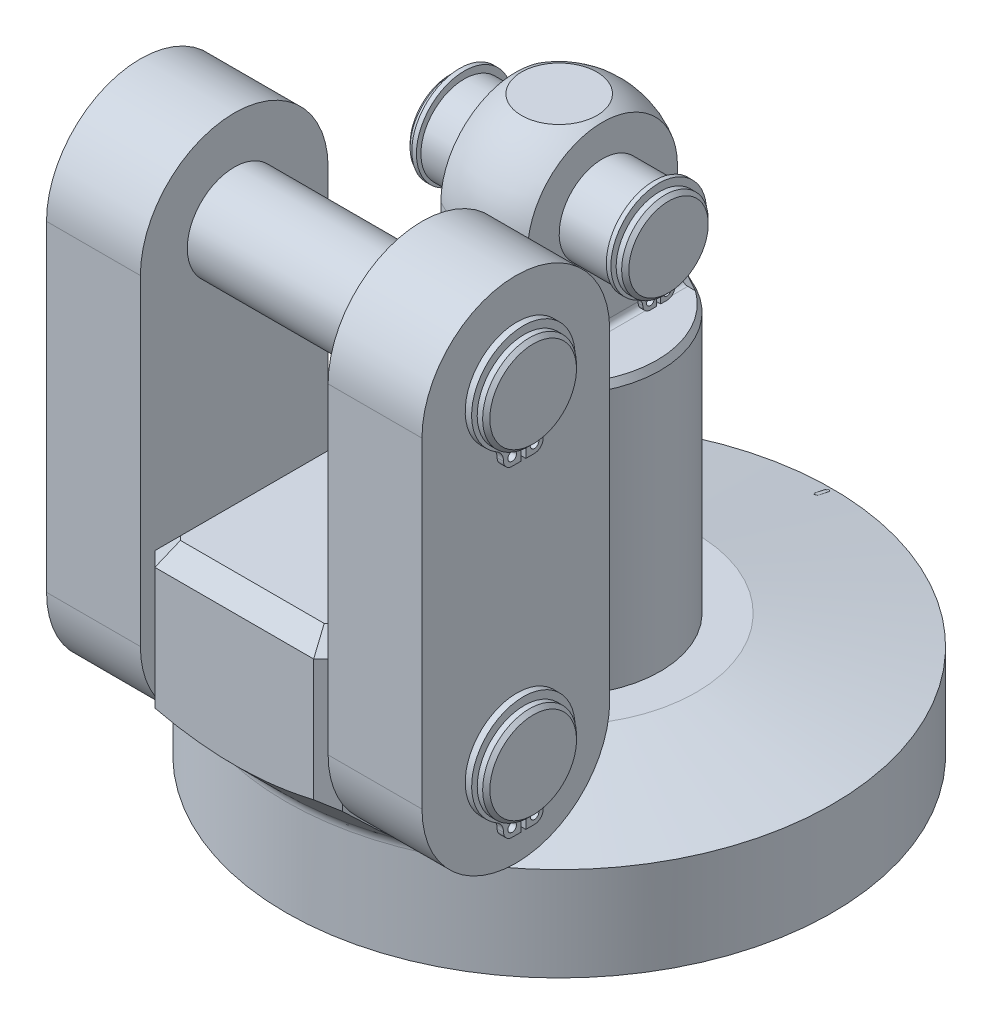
SolidWorks part; units mm, degrees
ref_plane "Front Plane" through (0, 0, 0) normal (0, 0, 1) x (1, 0, 0)
ref_plane "Top Plane" through (0, 0, 0) normal (0, 1, 0) x (1, 0, 0)
ref_plane "Right Plane" through (0, 0, 0) normal (1, 0, 0) x (0, 0, -1)
sketch "Sketch1" plane through (0, 0, 0) normal (0, 1, 0) x (1, 0, 0)
  line L0 (-13, 0) -> (13, 0)
  line L1 (13, 0) -> (13, -45)
  line L2 (13, -45) -> (-13, -45)
  line L3 (-13, -45) -> (-13, 0)
  line L4 (0, 1.05) -> (0, -22.05) construction
  dimension "D1" = 26
  dimension "D2" = 45
extrude "Extrude1" add sketch "Sketch1" along normal blind 42
sketch "S2D0003" plane through (0, 0, 0) normal (1, 0, 0) x (0, 0, -1)
  line L0 (0, 0) -> (0, 17)
  line L1 (-45, 0) -> (0, 0)
  line L2 (-45, 0) -> (-45, 11.4735)
  line L3 (0, 17) -> (-19, 17)
  line L4 (-19, 17) -> (-45, 11.4735)
  line L5 (0, 9.45) -> (0, -2.5987) construction
  line L6 (0, 42) -> (0, 0) construction
  line L8 (-45, 0) -> (0, 0) construction
  line L10 (-45, 42) -> (-45, 0) construction
  dimension "D1" = 17
  dimension "D2" = 12
  dimension "D3" = 38
sketch "S2D0004" plane through (0, 0, 0) normal (1, 0, 0) x (0, 0, -1)
  line L0 (-50, 26.2924) -> (-38.4318, 14.7242)
  line L1 (-37.846, 13.31) -> (-37.846, 0)
  line L2 (0, 16.6313) -> (0, -1.1122) construction
  line L3 (0, 42) -> (0, 0) construction
  line L5 (-45, 0) -> (0, 0) construction
  line L6 (-50, 26.2924) -> (-50, 0)
  line L7 (-50, 0) -> (-37.846, 0)
  line L8 (-45, 42) -> (-45, 0) construction
  arc A0 (-37.846, 13.31) -> (-38.4318, 14.7242) centre (-39.846, 13.31) ccw
  dimension "D4" = 2
  dimension "D1" = 75.692
  dimension "D2" = 13.31
  dimension "D3" = 45
  dimension "D5" = 5
sketch "Sketch4" plane through (0, 0, 0) normal (1, 0, 0) x (0, 0, -1)
  line L0 (0, 17) -> (19, 17)
  line L1 (19, 17) -> (19, 42)
  line L2 (19, 42) -> (0, 42)
  line L3 (0, 42) -> (0, 17)
  line L4 (0, 21.6) -> (0, 8.4) construction
  line L5 (0, 42) -> (0, 0) construction
  line L6 (-45, 42) -> (0, 42) construction
  dimension "D1" = 38
  dimension "D2" = 25
revolve "Cut-Revolve5" cut sketch "Sketch4" angle 360 about L4
revolve "Revolve1" add sketch "S2D0003" angle 360 about L5
revolve "Cut-Revolve4" cut sketch "S2D0004" angle 360 about L2
sketch "Sketch7" plane through (13, 0, 0) normal (1, 0, 0) x (0, 0, -1)
  line L0 (-37.846, 0) -> (37.846, 0) construction
  circle A0 centre (-32, 29) radius 6.5
  dimension "D1" = 13
  dimension "D2" = 29
  dimension "D3" = 32
extrude "Cut-Extrude3" cut sketch "Sketch7" against normal through all
fillet "Fillet1" radius 3.5052 2 edges at (-13, 29.5, 13.8564) (13, 29.5, 13.8564)
fillet "Fillet2" radius 4.7498 5 edges at (-11.296, 16.6296, 17.3972) (0, 17, 19) (11.333, 16.6213, 17.4197)
chamfer "Chamfer1" distance 2.0066 angle 45 2 edges at (-13, 32.5663, 45) (13, 32.5663, 45)
chamfer "Chamfer2" distance 2.5 angle 45 8 edges at (-13, 42, 31.6988) (-11.3793, 42, 17.4487) (0, 42, 19) (11.3793, 42, 17.4487) (-11.9967, 42, 43.9967) (13, 42, 31.6988) (11.9967, 42, 43.9967) (0, 42, 45)
ref_plane "Plane1" through (0, 0, 32) normal (0, 0, 1) x (1, 0, 0)
sketch "Sketch8" plane through (0, 0, 32) normal (0, 0, 1) x (1, 0, 0)
  line L0 (13, 29) -> (13, 15.5)
  line L1 (14.14, 14.36) -> (27.64, 14.36)
  line L2 (27.64, 14.36) -> (27.64, 29)
  line L3 (27.64, 29) -> (13, 29)
  line L4 (5.637, 29) -> (19.4125, 29) construction
  line L5 (-13, 29) -> (13, 29) construction
  line L6 (13, 42) -> (13, 23.1326) construction
  line L7 (0, 0) -> (0, 26.6501) construction
  line L8 (-27.64, 29) -> (-13, 29)
  line L9 (-27.64, 14.36) -> (-27.64, 29)
  line L10 (-14.14, 14.36) -> (-27.64, 14.36)
  line L11 (-13, 29) -> (-13, 15.5)
  arc A0 (13, 15.5) -> (14.14, 14.36) centre (14.14, 15.5) ccw
  arc A1 (-13, 15.5) -> (-14.14, 14.36) centre (-14.14, 15.5) cw
  dimension "D4" = 1.14
  dimension "D2" = 29.28
  dimension "D3" = 14.64
revolve "Cut-Revolve6" cut sketch "Sketch8" angle 360 about L4
sketch "Sketch10" plane through (0, 0, 0) normal (1, 0, 0) x (0, 0, -1)
  line L0 (0, 17) -> (0, 79.3)
  line L1 (0, 79.3) -> (5.2195, 79.3)
  line L2 (11.9951, 68.5) -> (11.9951, 57.3895)
  line L3 (11.9951, 57.3895) -> (13.9954, 53.1)
  line L4 (13.9954, 53.1) -> (13.9954, 17)
  line L5 (13.9954, 17) -> (0, 17)
  line L6 (0, 44.745) -> (0, 7.55) construction
  line L7 (22.759, -19) -> (-24.5324, -19) construction
  line L9 (19, 17) -> (-13.1229, 17) construction
  arc A0 (11.9951, 68.5) -> (5.2195, 79.3) centre (0, 68.5) ccw
  circle A1 centre (0, 68.5) radius 6 construction
  dimension "D2" = 11.9951
  dimension "D3" = 12
  dimension "D5" = 87.5
  dimension "D1" = 10.8
  dimension "D4" = 36
  dimension "D6" = 27.9908
  dimension "D7" = 23.9903
  dimension "D8" = 25
  dimension "D9" = 26.2
  dimension "D10" = 36.1
  dimension "D11" = 62.3
revolve "Revolve2" add sketch "Sketch10" angle 360 about L6
sketch "Sketch12" plane through (0, 0, 0) normal (0, 0, 1) x (1, 0, 0)
  line L0 (6, 79.3) -> (13.9954, 79.3)
  line L1 (13.9954, 79.3) -> (13.9954, 54.1)
  line L2 (13.9954, 54.1) -> (6.8, 54.1)
  line L3 (6, 54.9) -> (6, 79.3)
  line L4 (5.2195, 79.3) -> (-5.2195, 79.3) construction
  line L5 (13.9954, 17) -> (13.9954, 53.1) construction
  line L6 (-6, 54.9) -> (-6, 79.3)
  line L7 (-13.9954, 54.1) -> (-6.8, 54.1)
  line L8 (0, 38.525) -> (0, 26.975) construction
  line L9 (-13.9954, 79.3) -> (-13.9954, 54.1)
  line L10 (-6, 79.3) -> (-13.9954, 79.3)
  arc A0 (6, 54.9) -> (6.8, 54.1) centre (6.8, 54.9) ccw
  arc A1 (-6, 54.9) -> (-6.8, 54.1) centre (-6.8, 54.9) cw
  dimension "D3" = 0.8
  dimension "D1" = 12
  dimension "D2" = 25.2
extrude "Cut-Extrude5" cut sketch "Sketch12" against normal mid plane 22
sketch "Sketch14" plane through (6, 0, 0) normal (1, 0, 0) x (0, 0, -1)
  line L0 (5.2195, 79.3) -> (-5.2195, 79.3) construction
  circle A0 centre (0, 68.5) radius 6
  dimension "D2" = 12
  dimension "D1" = 10.8
extrude "Cut-Extrude7" cut sketch "Sketch14" against normal up to next
sketch "S2D0005" plane through (13, 0, 0) normal (1, 0, 0) x (0, 0, -1)
  line L0 (-45.0046, 73.4987) -> (-45, 28.9987)
  line L1 (-19.0046, 73.5013) -> (-19, 29.0013)
  line L2 (-32.0046, 73.5) -> (-32, 29) construction
  line L3 (0, 68.5) -> (-0.0006, 73.5038) construction
  line L4 (-0.0006, 73.5038) -> (-32.0046, 73.5) construction
  arc A0 (-19.0046, 73.5013) -> (-45.0046, 73.4987) centre (-32.0046, 73.5) ccw
  arc A1 (-45, 28.9987) -> (-19, 29.0013) centre (-32, 29) ccw
  circle A2 centre (-32.0046, 73.5) radius 6.5
  circle A3 centre (-32, 29) radius 6.5
  circle A6 centre (-32, 29) radius 6.5 construction
  dimension "D2" = 44.5
  dimension "D1" = 26
  dimension "D3" = 32.004
  dimension "D4" = 5.0038
extrude "Extrude2" add sketch "S2D0005" along normal blind 13
sketch "S2D0006" plane through (0, 0, 0) normal (0, 0, 1) x (1, 0, 0)
  line L0 (-13.15, 74.5) -> (13.15, 74.5)
  line L1 (15.15, 74) -> (15.15, 68.5)
  line L2 (14.65, 74.5) -> (15.15, 74)
  line L3 (13.89, 74.5) -> (14.65, 74.5)
  line L4 (13.89, 74.125) -> (13.89, 74.5)
  line L5 (13.15, 74.125) -> (13.89, 74.125)
  line L6 (13.15, 74.5) -> (13.15, 74.125)
  line L7 (15.15, 68.5) -> (-15.15, 68.5)
  line L8 (-13.15, 74.5) -> (-13.15, 74.125)
  line L9 (-13.15, 74.125) -> (-13.89, 74.125)
  line L10 (-13.89, 74.125) -> (-13.89, 74.5)
  line L11 (-13.89, 74.5) -> (-14.65, 74.5)
  line L12 (-14.65, 74.5) -> (-15.15, 74)
  line L13 (-15.15, 74) -> (-15.15, 68.5)
  line L14 (-8.415, 68.5) -> (8.415, 68.5) construction
  line L15 (-6, 68.5) -> (6, 68.5) construction
  line L16 (0, 40.8686) -> (0, 24.9357) construction
  line L17 (0, 57.3895) -> (0, 68.5) construction
  line L18 (6, 74.5) -> (-6, 74.5) construction
  dimension "D1" = 30.3
  dimension "D3" = 0.74
  dimension "D4" = 11.25
  dimension "D5" = 26.3
  dimension "D6" = 0.5
  dimension "D7" = 45
revolve "Revolve3" add sketch "S2D0006" angle 360 about L14
ref_plane "Plane2" through (0, 0, 32) normal (0, 0, 1) x (1, 0, 0)
sketch "Sketch18" plane through (0, 0, 32) normal (0, 0, 1) x (1, 0, 0)
  line L0 (-26.15, 35.5) -> (26.15, 35.5)
  line L1 (28.4, 35) -> (28.4, 29)
  line L2 (27.9, 35.5) -> (28.4, 35)
  line L3 (27.15, 35.5) -> (27.9, 35.5)
  line L4 (27.15, 34.945) -> (27.15, 35.5)
  line L5 (26.15, 34.945) -> (27.15, 34.945)
  line L6 (26.15, 35.5) -> (26.15, 34.945)
  line L7 (-26.15, 35.5) -> (-26.15, 34.945)
  line L8 (-26.15, 34.945) -> (-27.15, 34.945)
  line L9 (-27.15, 34.945) -> (-27.15, 35.5)
  line L10 (-27.15, 35.5) -> (-27.9, 35.5)
  line L11 (-27.9, 35.5) -> (-28.4, 35)
  line L12 (-28.4, 35) -> (-28.4, 29)
  line L13 (-13.915, 29) -> (13.915, 29) construction
  line L14 (-13, 29) -> (26, 29) construction
  line L15 (0, 28.7058) -> (0, -18.8155) construction
  line L16 (-28.4, 29) -> (28.4, 29)
  line L17 (26, 35.5) -> (-13, 35.5) construction
  dimension "D2" = 56.8
  dimension "D3" = 11.89
  dimension "D4" = 1
  dimension "D5" = 52.3
  dimension "D6" = 0.5
  dimension "D7" = 45
revolve "Revolve4" add sketch "Sketch18" angle 360 about L13
sketch "Sketch20" plane through (13.15, 0, 0) normal (1, 0, 0) x (0, 0, -1)
  line L0 (0.2794, 60.8372) -> (1.169, 60.8372)
  line L1 (0.2794, 63.0722) -> (0.2794, 60.8372)
  line L2 (-0.2794, 63.0722) -> (-0.2794, 60.8372)
  line L3 (-0.2794, 60.8372) -> (-1.169, 60.8372)
  line L4 (0, 30.527) -> (0, 23.2449) construction
  arc A0 (0.2794, 63.0722) -> (-0.2794, 63.0722) centre (0, 68.5) ccw
  arc A1 (2.8303, 62.8456) -> (-2.8303, 62.8456) centre (0, 68.8348) ccw
  circle A2 centre (0, 68.5) radius 6 construction
  circle A3 centre (1.169, 61.8782) radius 0.5205
  arc A4 (2.21, 61.8724) -> (1.169, 60.8372) centre (1.169, 61.8782) cw
  arc A5 (-2.21, 61.8724) -> (-2.8303, 62.8456) centre (-3.2931, 61.8663) ccw
  arc A6 (-2.21, 61.8724) -> (-1.169, 60.8372) centre (-1.169, 61.8782) ccw
  circle A7 centre (-1.169, 61.8782) radius 0.5205
  arc A8 (2.21, 61.8724) -> (2.8303, 62.8456) centre (3.2931, 61.8663) cw
  dimension "D1" = 0.5587
  dimension "D2" = 5.435
  dimension "D3" = 6.6242
  dimension "D4" = 0.3348
  dimension "D6" = 1.041
  dimension "D9" = 1.041
  dimension "D10" = 1.0832
  dimension "D7" = 2.338
  dimension "D8" = 6.6218
extrude "Extrude4" add sketch "Sketch20" along normal blind 0.635
sketch "Sketch21" plane through (26.15, 0, 0) normal (1, 0, 0) x (0, 0, -1)
  line L0 (-31.6562, 20.4127) -> (-30.4501, 20.4129)
  line L1 (-31.6565, 23.1556) -> (-31.6562, 20.4127)
  line L2 (-32.3423, 23.1555) -> (-32.342, 20.4127)
  line L3 (-32.342, 20.4127) -> (-33.5481, 20.4125)
  line L4 (-31.9979, 8.8095) -> (-31.9973, 2.732) construction
  line L5 (-45.0046, 73.4987) -> (-45, 28.9987) construction
  arc A0 (-31.6565, 23.1556) -> (-32.3423, 23.1555) centre (-32, 29) ccw
  arc A1 (-28.3621, 23.1721) -> (-35.6367, 23.1714) centre (-32, 29.3425) ccw
  circle A2 centre (-30.4502, 21.6069) radius 0.597
  arc A3 (-29.2562, 21.6069) -> (-30.4501, 20.4129) centre (-30.4502, 21.6069) cw
  arc A4 (-29.2562, 21.6069) -> (-28.3621, 23.1721) centre (-27.4394, 21.607) cw
  arc A5 (-34.7422, 21.6064) -> (-35.6367, 23.1714) centre (-36.5591, 21.6061) ccw
  arc A6 (-34.7422, 21.6064) -> (-33.5481, 20.4125) centre (-33.5482, 21.6065) ccw
  circle A7 centre (-33.5482, 21.6065) radius 0.597
  circle A8 centre (-32, 29) radius 6.5 construction
  dimension "D1" = 5.8545
  dimension "D2" = 7.163
  dimension "D3" = 0.3425
  dimension "D7" = 1.194
  dimension "D8" = 1.194
  dimension "D9" = 7.3935
  dimension "D10" = 1.8168
  dimension "D4" = 0.6857
  dimension "D6" = 3.098
extrude "Extrude5" add sketch "Sketch21" along normal blind 0.889
pattern_linear "LPattern1" count 2 spacing 44.5 along (0, 1, 0.0001) of "Extrude5", "Revolve4"
mirror "Mirror1" about plane through (0, 0, 0) normal (1, 0, 0) of "Extrude5", "LPattern1", "Extrude4", "Extrude2"
sketch "Sketch22" plane through (0, 0, 0) normal (1, 0, 0) x (0, 0, -1)
  line L0 (37.5085, 13.8429) -> (35.1799, 14.3378) construction
  line L1 (37.846, 12.9942) -> (19, 17) construction
  line L2 (37.3569, 13.0981) -> (35.4006, 13.5139) construction
  line L3 (35.803, 14.2054) -> (37.2706, 13.8934) construction
  line L5 (35.6367, 13.4229) -> (37.1043, 13.1109)
  line L6 (35.0205, 14.3717) -> (38.0531, 13.7271)
  arc A0 (35.0205, 14.3717) -> (35.6367, 13.4229) centre (35.803, 14.2054) ccw
  arc A1 (37.1043, 13.1109) -> (38.0531, 13.7271) centre (37.2706, 13.8934) ccw
  dimension "D2" = 1.6
  dimension "D1" = 0.76
  dimension "D3" = 2
  dimension "D4" = 0.5
revolve "Cut-Revolve7" cut sketch "Sketch22" angle 360 about L6
